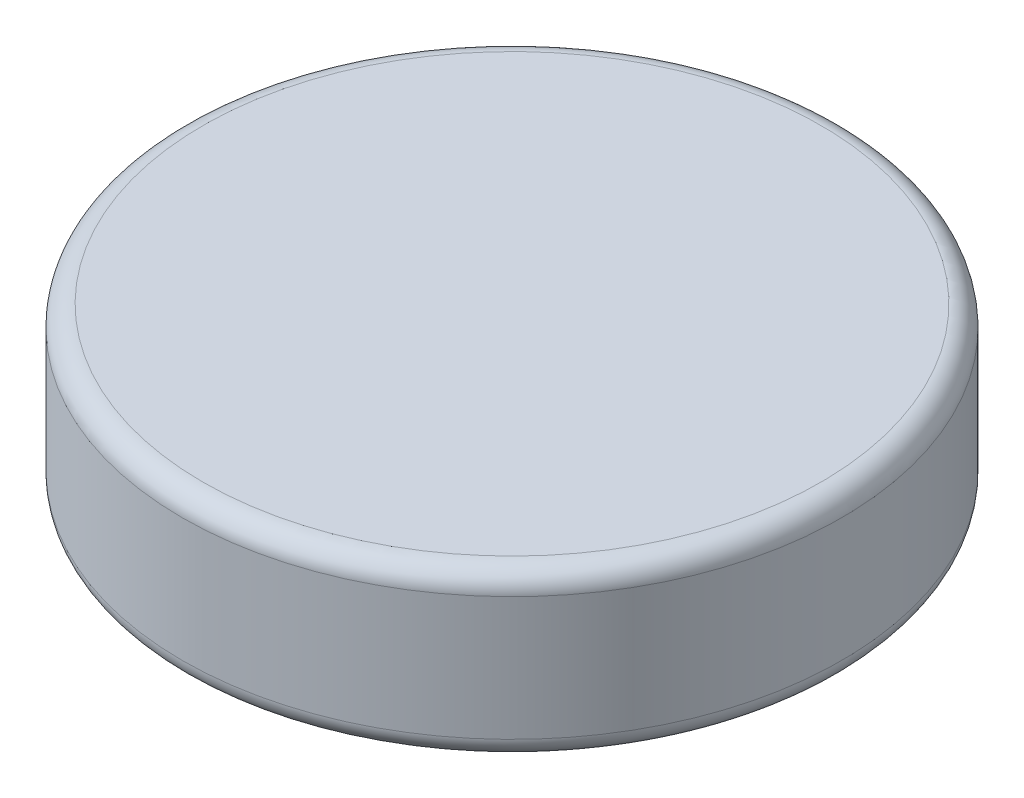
SolidWorks part; units mm, degrees
ref_plane "Front Plane" through (0, 0, 0) normal (0, 0, 1) x (1, 0, 0)
ref_plane "Top Plane" through (0, 0, 0) normal (0, 1, 0) x (1, 0, 0)
ref_plane "Right Plane" through (0, 0, 0) normal (1, 0, 0) x (0, 0, -1)
sketch "Sketch1" plane through (0, 0, 0) normal (0, 1, 0) x (1, 0, 0)
  circle A0 centre (0, 0) radius 4.064
  dimension "D1" = 8.128
extrude "Boss-Extrude1" add sketch "Sketch1" along normal blind 2.032
fillet "Fillet1" radius 0.254 2 edges at (0, 0, 4.064) (0, 2.032, 4.064)
